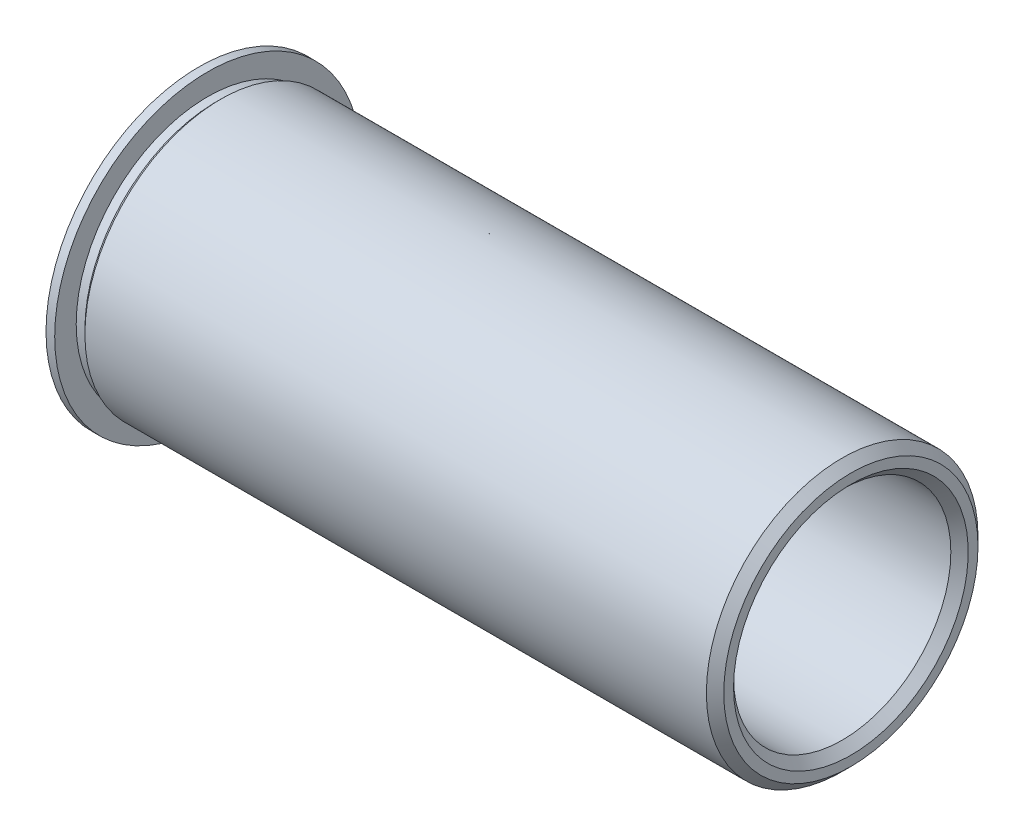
SolidWorks part; units mm, degrees
ref_plane "Front Plane" through (0, 0, 0) normal (0, 0, 1) x (1, 0, 0)
ref_plane "Top Plane" through (0, 0, 0) normal (0, 1, 0) x (1, 0, 0)
ref_plane "Right Plane" through (0, 0, 0) normal (1, 0, 0) x (0, 0, -1)
sketch "Sketch2" plane through (0, 0, 0) normal (0, 0, 1) x (1, 0, 0)
  line L0 (-64.1411, 94.6527) -> (-64.1411, 99.1231)
  line L1 (-64.1411, 99.1231) -> (-63.8871, 99.1231)
  line L2 (-64.1411, 94.6527) -> (-45.0911, 94.6527)
  line L3 (-45.0911, 94.6527) -> (-45.0911, 98.3674)
  line L4 (-45.0911, 98.3674) -> (-45.3451, 98.6214)
  line L5 (-45.3451, 98.6214) -> (-63.5061, 98.6214)
  line L6 (-63.5061, 98.6214) -> (-63.6331, 98.4944)
  line L7 (-63.6331, 98.4944) -> (-63.8871, 98.4944)
  line L8 (-63.8871, 98.4944) -> (-63.8871, 99.1231)
  dimension "D1" = 4.4704
  dimension "D2" = 0.254
  dimension "D3" = 3.9688
  dimension "D4" = 0.254
  dimension "D5" = 0.254
  dimension "D6" = 19.05
  dimension "D7" = 0.127
  dimension "D8" = 0.254
revolve "Revolve3" add sketch "Sketch2" angle 360 about L2
sketch "Sketch3" plane through (-45.0911, 0, 0) normal (1, 0, 0) x (0, 0, -1)
  circle A0 centre (0, 94.6527) radius 3.175
  dimension "D1" = 6.35
extrude "Cut-Extrude1" cut sketch "Sketch3" against normal through all
chamfer "Chamfer2" distance 0.254 angle 45 1 edges at (-64.1411, 94.6527, -3.175)
chamfer "Chamfer3" distance 0.254 angle 45 1 edges at (-45.0911, 94.6527, -3.175)
